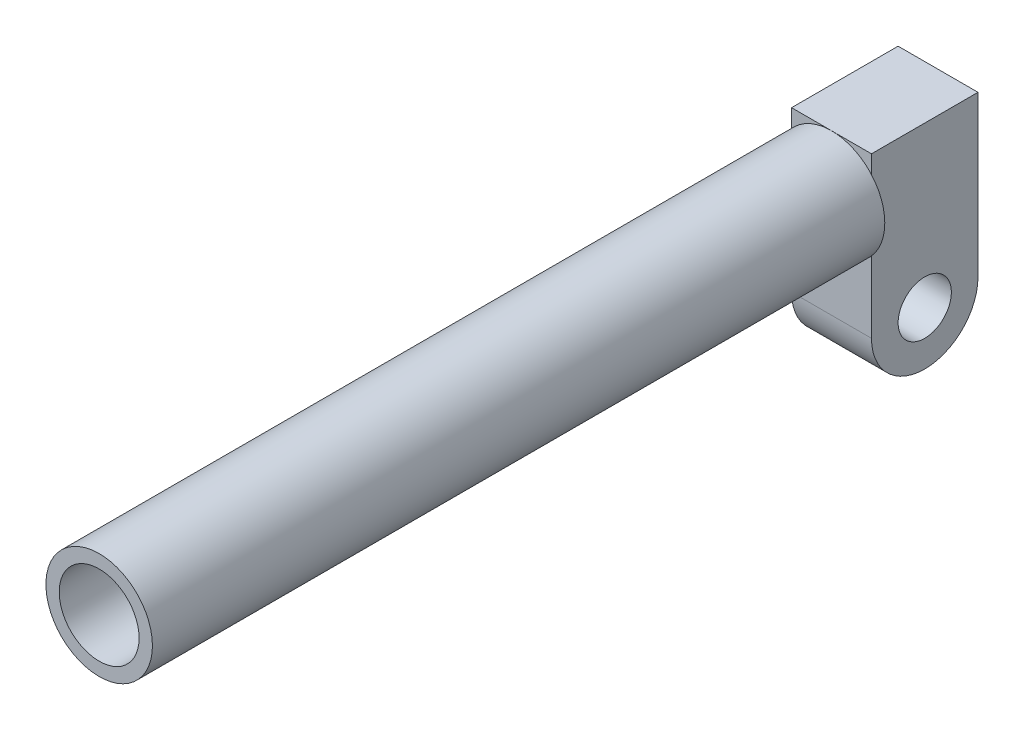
SolidWorks part; units mm, degrees
ref_plane "Front Plane" through (0, 0, 0) normal (0, 0, 1) x (1, 0, 0)
ref_plane "Top Plane" through (0, 0, 0) normal (0, 1, 0) x (1, 0, 0)
ref_plane "Right Plane" through (0, 0, 0) normal (1, 0, 0) x (0, 0, -1)
sketch "Sketch1" plane through (0, 0, 0) normal (1, 0, 0) x (0, 0, -1)
  line L0 (-40, 0) -> (-40, 120)
  line L1 (-40, 120) -> (40, 120)
  line L2 (40, 120) -> (40, 0)
  circle A0 centre (0, 0) radius 20
  circle A1 centre (0, 0) radius 40
  dimension "D1" = 40
  dimension "D2" = 80
  dimension "D3" = 120
extrude "Boss-Extrude1" add sketch "Sketch1" along normal mid plane 60 contours A1 L2 L1 L0 | A1 A0
sketch "Sketch2" plane through (0, 0, 40) normal (0, 0, 1) x (1, 0, 0)
  line L0 (0, 0) -> (0, 80) construction
  line L1 (30, 0) -> (-30, 0) construction
  line L2 (30, 120) -> (-30, 120) construction
  circle A0 centre (0, 80) radius 40
  circle A1 centre (0, 80) radius 30
  dimension "D1" = 80
  dimension "D2" = 60
extrude "Boss-Extrude3" add sketch "Sketch2" along normal blind 550 separate body
